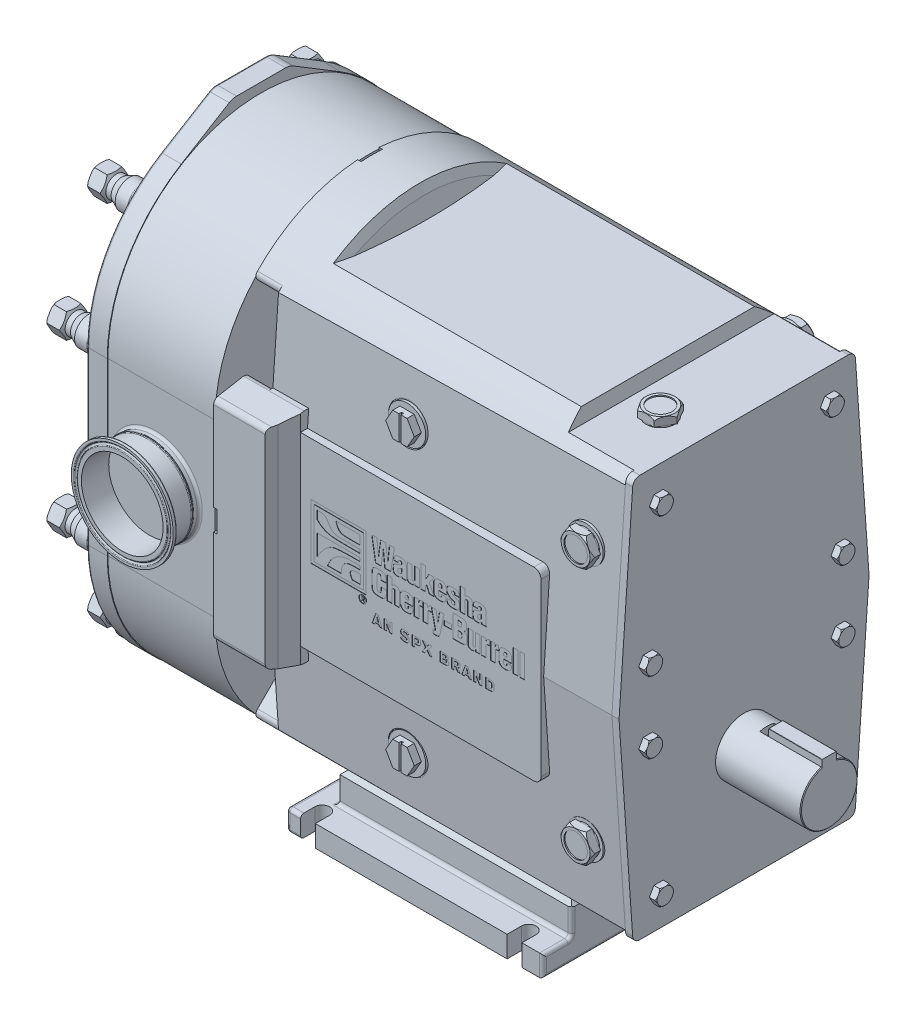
SolidWorks part; units mm, degrees
ref_plane "Front Plane" through (0, 0, 0) normal (0, 0, 1) x (1, 0, 0)
ref_plane "Top Plane" through (0, 0, 0) normal (0, 1, 0) x (1, 0, 0)
ref_plane "Right Plane" through (0, 0, 0) normal (1, 0, 0) x (0, 0, -1)
other "Join1"
other "101851<1>@180_U2_Lower Shaft"
other "107234<1>@180_U2_Lower Shaft"
other "230110000<1>@180_U2_Lower Shaft"
other "230005000<1>@180_U2_Lower Shaft"
other "grease fitting<4>@180_U2_Lower Shaft"
other "grease fitting<2>@180_U2_Lower Shaft"
other "cleanout plug<2>@180_U2_Lower Shaft"
other "oil plug<6>@180_U2_Lower Shaft"
other "oil plug<4>@180_U2_Lower Shaft"
other "108372<8>@180_U2_Lower Shaft"
other "108372<7>@180_U2_Lower Shaft"
other "108372<6>@180_U2_Lower Shaft"
other "108372<4>@180_U2_Lower Shaft"
other "108372<3>@180_U2_Lower Shaft"
other "108372<2>@180_U2_Lower Shaft"
other "Key_220<1>@180_U2_Lower Shaft"
other "Shaft_220<1>@180_U2_Lower Shaft"
other "grease fitting<3>@180_U2_Lower Shaft"
other "grease fitting<1>@180_U2_Lower Shaft"
other "cleanout plug<1>@180_U2_Lower Shaft"
other "oil plug<5>@180_U2_Lower Shaft"
other "oil plug<3>@180_U2_Lower Shaft"
other "oil plug<2>@180_U2_Lower Shaft"
other "oil plug<1>@180_U2_Lower Shaft"
other "plate_220<1>@180_U2_Lower Shaft"
other "108372<5>@180_U2_Lower Shaft"
other "108372<1>@180_U2_Lower Shaft"
other "130360008<2>@180_U2_Lower Shaft"
other "130360008<1>@180_U2_Lower Shaft"
